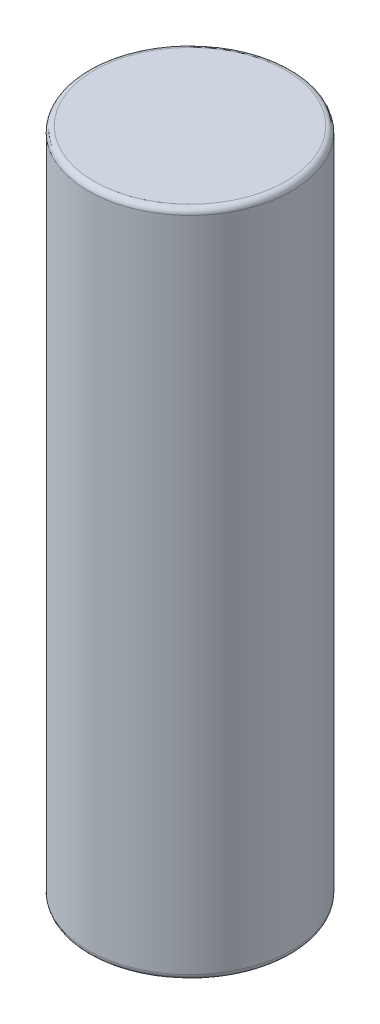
SolidWorks part; units mm, degrees
ref_plane "Front Plane" through (0, 0, 0) normal (0, 0, 1) x (1, 0, 0)
ref_plane "Top Plane" through (0, 0, 0) normal (0, 1, 0) x (1, 0, 0)
ref_plane "Right Plane" through (0, 0, 0) normal (1, 0, 0) x (0, 0, -1)
sketch "Sketch1" plane through (0, 0, 0) normal (0, 1, 0) x (1, 0, 0)
  circle A0 centre (0, 0) radius 10.75
  dimension "D1" = 21.5
extrude "Boss-Extrude1" add sketch "Sketch1" along normal blind 70.7
fillet "Fillet1" radius 0.6 2 edges at (0, 0, 10.75) (0, 70.7, 10.75)
